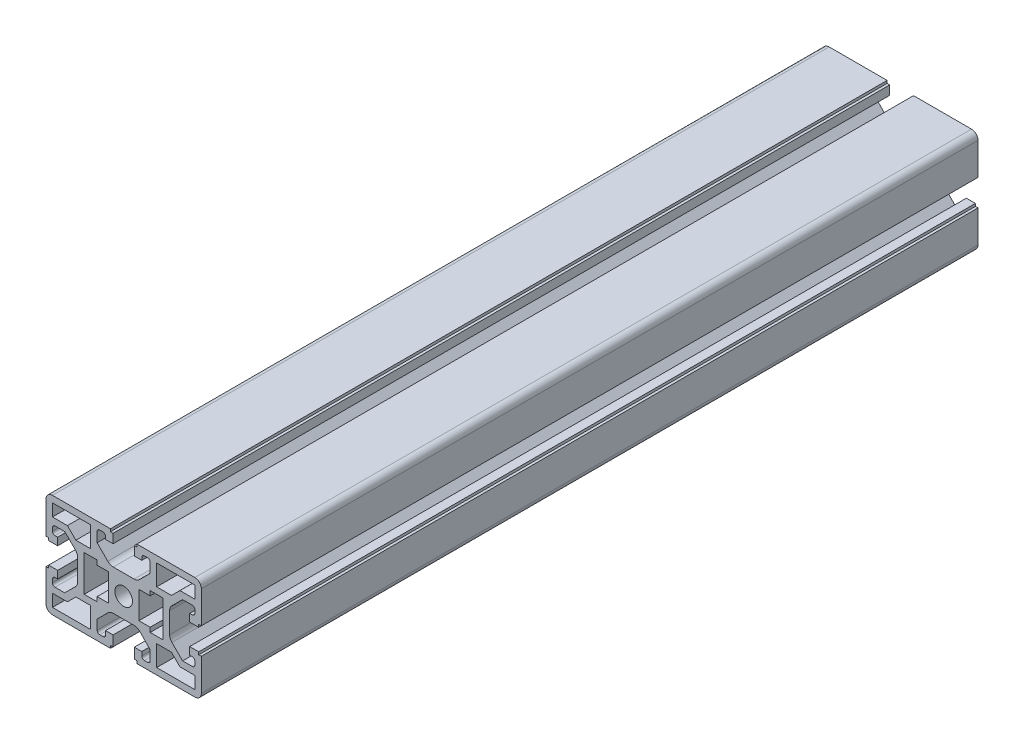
SolidWorks part; units mm, degrees
ref_plane "前视基准面" through (0, 0, 0) normal (0, 0, 1) x (1, 0, 0)
ref_plane "上视基准面" through (0, 0, 0) normal (0, 1, 0) x (1, 0, 0)
ref_plane "右视基准面" through (0, 0, 0) normal (1, 0, 0) x (0, 0, -1)
sketch "草图1" plane through (0, 0, 0) normal (0, 0, 1) x (1, 0, 0)
  line B0 (5.9, 5.25) -> (10.25, 5.25)
  line B1 (10.25, 5.25) -> (10.25, 7)
  line B2 (10.25, 7) -> (15.25, 7)
  line B3 (15.25, 7) -> (15.25, -7)
  line B4 (15.25, -7) -> (10.25, -7)
  line B5 (10.25, -7) -> (10.25, -5.25)
  line B6 (10.25, -5.25) -> (5.9, -5.25)
  line B7 (5.9, -5.25) -> (5.9, 5.25)
  line B8 (-27.5, 17.5) -> (-12.75, 17.5)
  line B9 (-12.75, 17.5) -> (-12.75, 9.5)
  line B10 (-12.75, 9.5) -> (-18.462, 9.5)
  line B11 (-18.462, 9.5) -> (-21.7348, 12.75)
  line B12 (-21.7348, 12.75) -> (-27.5, 12.75)
  line B13 (-27.5, 12.75) -> (-27.5, 17.5)
  line B14 (-10.25, 7) -> (-10.25, 5.25)
  line B15 (-10.25, 5.25) -> (-5.9, 5.25)
  line B16 (-5.9, 5.25) -> (-5.9, -5.25)
  line B17 (-5.9, -5.25) -> (-10.25, -5.25)
  line B18 (-10.25, -5.25) -> (-10.25, -7)
  line B19 (-10.25, -7) -> (-15.25, -7)
  line B20 (-15.25, -7) -> (-15.25, 7)
  line B21 (-15.25, 7) -> (-10.25, 7)
  line B22 (-4.0209, -7.75) -> (4.0209, -7.75)
  line B23 (6.1496, -8.6361) -> (10.25, -12.7652)
  line B24 (10.25, -12.7652) -> (10.25, -16.5)
  line B25 (9.25, -17.5) -> (8, -17.5)
  line B26 (7, -16.5) -> (7, -15)
  line B27 (7, -15) -> (4.1, -15)
  line B28 (4.1, -15) -> (4.1, -19)
  line B29 (4.1, -19) -> (5.1, -19)
  line B30 (5.1, -19) -> (5.1, -20)
  line B31 (5.1, -20) -> (27.5, -20)
  line B32 (30, -17.5) -> (30, -5.1)
  line B33 (30, -5.1) -> (29, -5.1)
  line B34 (29, -5.1) -> (29, -4.1)
  line B35 (29, -4.1) -> (25.5, -4.1)
  line B36 (25.5, -4.1) -> (25.5, -7)
  line B37 (25.5, -7) -> (26.5, -7)
  line B38 (27.5, -8) -> (27.5, -9.25)
  line B39 (26.5, -10.25) -> (22.7652, -10.25)
  line B40 (22.7652, -10.25) -> (18.6361, -6.1496)
  line B41 (17.75, -4.0209) -> (17.75, 4.0209)
  line B42 (18.6361, 6.1496) -> (22.7652, 10.25)
  line B43 (22.7652, 10.25) -> (26.5, 10.25)
  line B44 (27.5, 9.25) -> (27.5, 8)
  line B45 (26.5, 7) -> (25.5, 7)
  line B46 (25.5, 7) -> (25.5, 4.1)
  line B47 (25.5, 4.1) -> (29, 4.1)
  line B48 (29, 4.1) -> (29, 5.1)
  line B49 (29, 5.1) -> (30, 5.1)
  line B50 (30, 5.1) -> (30, 17.5)
  line B51 (27.5, 20) -> (5.1, 20)
  line B52 (5.1, 20) -> (5.1, 19)
  line B53 (5.1, 19) -> (4.1, 19)
  line B54 (4.1, 19) -> (4.1, 15.5)
  line B55 (4.1, 15.5) -> (7, 15.5)
  line B56 (7, 15.5) -> (7, 16.5)
  line B57 (8, 17.5) -> (9.25, 17.5)
  line B58 (10.25, 16.5) -> (10.25, 12.7652)
  line B59 (10.25, 12.7652) -> (6.1496, 8.6361)
  line B60 (4.0209, 7.75) -> (-4.0209, 7.75)
  line B61 (-6.1496, 8.6361) -> (-10.25, 12.7652)
  line B62 (-10.25, 12.7652) -> (-10.25, 16.5)
  line B63 (-9.25, 17.5) -> (-8, 17.5)
  line B64 (-7, 16.5) -> (-7, 15.5)
  line B65 (-7, 15.5) -> (-4.1, 15.5)
  line B66 (-4.1, 15.5) -> (-4.1, 19)
  line B67 (-4.1, 19) -> (-5.1, 19)
  line B68 (-5.1, 19) -> (-5.1, 20)
  line B69 (-5.1, 20) -> (-27.5, 20)
  line B70 (-30, 17.5) -> (-30, 5.1)
  line B71 (-30, 5.1) -> (-29, 5.1)
  line B72 (-29, 5.1) -> (-29, 4.1)
  line B73 (-29, 4.1) -> (-25.5, 4.1)
  line B74 (-25.5, 4.1) -> (-25.5, 7)
  line B75 (-25.5, 7) -> (-26.5, 7)
  line B76 (-27.5, 8) -> (-27.5, 9.25)
  line B77 (-26.5, 10.25) -> (-22.7652, 10.25)
  line B78 (-22.7652, 10.25) -> (-18.6361, 6.1496)
  line B79 (-17.75, 4.0209) -> (-17.75, -4.0209)
  line B80 (-18.6361, -6.1496) -> (-22.7652, -10.25)
  line B81 (-22.7652, -10.25) -> (-26.5, -10.25)
  line B82 (-27.5, -9.25) -> (-27.5, -8)
  line B83 (-26.5, -7) -> (-25.5, -7)
  line B84 (-25.5, -7) -> (-25.5, -4.1)
  line B85 (-25.5, -4.1) -> (-29, -4.1)
  line B86 (-29, -4.1) -> (-29, -5.1)
  line B87 (-29, -5.1) -> (-30, -5.1)
  line B88 (-30, -5.1) -> (-30, -17.5)
  line B89 (-27.5, -20) -> (-5.1, -20)
  line B90 (-5.1, -20) -> (-5.1, -19)
  line B91 (-5.1, -19) -> (-4.1, -19)
  line B92 (-4.1, -19) -> (-4.1, -15)
  line B93 (-4.1, -15) -> (-7, -15)
  line B94 (-7, -15) -> (-7, -16.5)
  line B95 (-8, -17.5) -> (-9.25, -17.5)
  line B96 (-10.25, -16.5) -> (-10.25, -12.7652)
  line B97 (-10.25, -12.7652) -> (-6.1496, -8.6361)
  line B98 (27.5, 17.5) -> (12.75, 17.5)
  line B99 (12.75, 17.5) -> (12.75, 9.5)
  line B100 (12.75, 9.5) -> (18.462, 9.5)
  line B101 (18.462, 9.5) -> (21.7348, 12.75)
  line B102 (21.7348, 12.75) -> (27.5, 12.75)
  line B103 (27.5, 12.75) -> (27.5, 17.5)
  line B104 (-27.5, -17.5) -> (-12.75, -17.5)
  line B105 (-12.75, -17.5) -> (-12.75, -9.5)
  line B106 (-12.75, -9.5) -> (-18.462, -9.5)
  line B107 (-18.462, -9.5) -> (-21.7348, -12.75)
  line B108 (-21.7348, -12.75) -> (-27.5, -12.75)
  line B109 (-27.5, -12.75) -> (-27.5, -17.5)
  line B110 (27.5, -17.5) -> (12.75, -17.5)
  line B111 (12.75, -17.5) -> (12.75, -9.5)
  line B112 (12.75, -9.5) -> (18.462, -9.5)
  line B113 (18.462, -9.5) -> (21.7348, -12.75)
  line B114 (21.7348, -12.75) -> (27.5, -12.75)
  line B115 (27.5, -12.75) -> (27.5, -17.5)
  arc B116 (6.1496, -8.6361) -> (4.0209, -7.75) centre (4.0209, -10.75) ccw
  arc B117 (9.25, -17.5) -> (10.25, -16.5) centre (9.25, -16.5) ccw
  arc B118 (7, -16.5) -> (8, -17.5) centre (8, -16.5) ccw
  arc B119 (27.5, -20) -> (30, -17.5) centre (27.5, -17.5) ccw
  arc B120 (27.5, -8) -> (26.5, -7) centre (26.5, -8) ccw
  arc B121 (26.5, -10.25) -> (27.5, -9.25) centre (26.5, -9.25) ccw
  arc B122 (17.75, -4.0209) -> (18.6361, -6.1496) centre (20.75, -4.0209) ccw
  arc B123 (18.6361, 6.1496) -> (17.75, 4.0209) centre (20.75, 4.0209) ccw
  arc B124 (27.5, 9.25) -> (26.5, 10.25) centre (26.5, 9.25) ccw
  arc B125 (26.5, 7) -> (27.5, 8) centre (26.5, 8) ccw
  arc B126 (30, 17.5) -> (27.5, 20) centre (27.5, 17.5) ccw
  arc B127 (8, 17.5) -> (7, 16.5) centre (8, 16.5) ccw
  arc B128 (10.25, 16.5) -> (9.25, 17.5) centre (9.25, 16.5) ccw
  arc B129 (4.0209, 7.75) -> (6.1496, 8.6361) centre (4.0209, 10.75) ccw
  arc B130 (-6.1496, 8.6361) -> (-4.0209, 7.75) centre (-4.0209, 10.75) ccw
  arc B131 (-9.25, 17.5) -> (-10.25, 16.5) centre (-9.25, 16.5) ccw
  arc B132 (-7, 16.5) -> (-8, 17.5) centre (-8, 16.5) ccw
  arc B133 (-27.5, 20) -> (-30, 17.5) centre (-27.5, 17.5) ccw
  arc B134 (-27.5, 8) -> (-26.5, 7) centre (-26.5, 8) ccw
  arc B135 (-26.5, 10.25) -> (-27.5, 9.25) centre (-26.5, 9.25) ccw
  arc B136 (-17.75, 4.0209) -> (-18.6361, 6.1496) centre (-20.75, 4.0209) ccw
  arc B137 (-18.6361, -6.1496) -> (-17.75, -4.0209) centre (-20.75, -4.0209) ccw
  arc B138 (-27.5, -9.25) -> (-26.5, -10.25) centre (-26.5, -9.25) ccw
  arc B139 (-26.5, -7) -> (-27.5, -8) centre (-26.5, -8) ccw
  arc B140 (-30, -17.5) -> (-27.5, -20) centre (-27.5, -17.5) ccw
  arc B141 (-8, -17.5) -> (-7, -16.5) centre (-8, -16.5) ccw
  arc B142 (-10.25, -16.5) -> (-9.25, -17.5) centre (-9.25, -16.5) ccw
  arc B143 (-4.0209, -7.75) -> (-6.1496, -8.6361) centre (-4.0209, -10.75) ccw
  circle B144 centre (0, 0) radius 3.4
sketch_block_instance "A$C5ADE5F0E-1"
sketch_block "A$C5ADE5F0E"
extrude "凸台-拉伸1" add sketch "草图1" along normal mid plane 300
